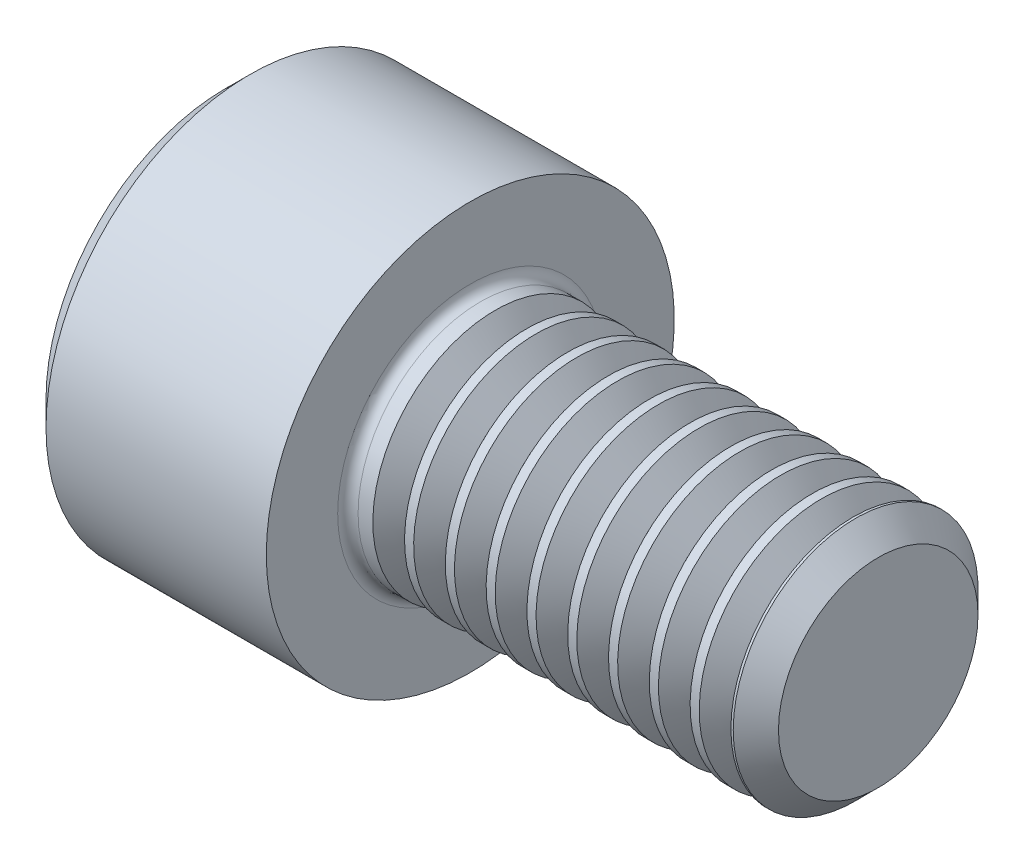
SolidWorks part; units mm, degrees
ref_plane "Plane1" through (0, 0, 0) normal (0, 0, 1) x (1, 0, 0)
ref_plane "Plane2" through (0, 0, 0) normal (0, 1, 0) x (1, 0, 0)
ref_plane "Plane3" through (0, 0, 0) normal (1, 0, 0) x (0, 0, -1)
sketch "BodySke" plane through (0, 0, 0) normal (0, 0, 1) x (1, 0, 0)
  line L0 (0, 0) -> (0, 4.4)
  line L1 (0.6, 5) -> (6, 5)
  line L2 (6, 5) -> (6, 3)
  line L3 (6, 3) -> (15.4455, 3)
  line L4 (16, 2.4455) -> (16, 0)
  line L5 (16, 0) -> (0, 0)
  line L6 (-31.75, 0) -> (127, 0) construction
  line L7 (0, 4.4) -> (0.6, 5)
  line L8 (16, 2.4455) -> (15.4455, 3)
  line L9 (0, -4.4) -> (0.6, -5) construction
  line L10 (16, -2.4455) -> (15.4455, -3) construction
  line L11 (7, 9.525) -> (7, 3.175) construction
  line L12 (6, 9.525) -> (6, 3.175) construction
  line L13 (-34, 9.525) -> (-34, 3.175) construction
  dimension "Diameter" = 6
  dimension "Head_ht" = 6
  dimension "Length" = 10
  dimension "Body_ch_ang" = 45
  dimension "Head_dia" = 10
  dimension "Head_ch_ang" = 45
  dimension "Minor_dia" = 4.891
  dimension "Advance" = 1
  dimension "Thread_nom" = 10
  dimension "Thread_length" = 50
  dimension "Head_ch_ht" = 0.6
revolve "Base-Revolve" add sketch "BodySke"
fillet "Fillet1" radius 0.25 1 edges at (6, 0, 3)
sketch "Sketch2" plane through (0, 0, 0) normal (0, 0, 1) x (1, 0, 0)
  line L0 (0, 2.542) -> (3, 2.542)
  line L1 (3, 2.542) -> (4.4676, 0)
  line L2 (-31.75, 0) -> (127, 0) construction
  line L3 (4.4676, 0) -> (0, 0)
  line L4 (0, 0) -> (0, 2.542)
  line L5 (0, 4.4) -> (0, -4.4) construction
  line L6 (0, 0) -> (47.625, 0) construction
  line L7 (6, -5) -> (6, 5) construction
  dimension "D1" = 2.542
  dimension "D2" = 60
  dimension "Wall_thickness" = 3
revolve "Hex-PreBroach" cut sketch "Sketch2" angle 360 about L6
sketch "Sketch3" plane through (0, 0, 0) normal (-1, 0, 0) x (0, 0.5, 0.866)
  line L0 (1.4676, 2.542) -> (-1.4676, 2.542)
  line L1 (-1.4676, 2.542) -> (-2.9352, 0)
  line L2 (1.4676, 2.542) -> (2.9352, 0)
  line L3 (1.4676, -2.542) -> (2.9352, 0)
  line L4 (1.4676, -2.542) -> (-1.4676, -2.542)
  line L5 (-1.4676, -2.542) -> (-2.9352, 0)
  dimension "D1" = 2.542
  dimension "D2" = 2.542
  dimension "Hex_size" = 5.084
extrude "Hex" cut sketch "Sketch3" against normal blind 3
sketch "Sketch4" plane through (0, 0, 0) normal (-1, 0, 0) x (0, 0, 1)
  line L0 (0, 0) -> (2.8067, 0)
  line L1 (0, 0) -> (6.1484, 3.5498) construction
  line L2 (0, 0) -> (1.4033, 2.4307)
  line L3 (2.3336, 0.614) -> (2.6851, 0.817)
  line L4 (1.6986, 1.7139) -> (2.0501, 1.9169)
  arc A0 (2.3336, 0.614) -> (1.6986, 1.7139) centre (0, 0) ccw
  arc A1 (2.8067, 0) -> (2.6851, 0.817) centre (0, 0) ccw
  arc A2 (1.4033, 2.4307) -> (2.0501, 1.9169) centre (0, 0) cw
  dimension "D1" = 30
  dimension "Spline_n_dim" = 4.826
  dimension "Spline_m_dim" = 5.6134
  dimension "D2" = 60
  dimension "D3" = 0.635
  dimension "Spline_p_dim" = 1.27
extrude "Spline" [suppressed] cut sketch "Sketch4" against normal blind 3
pattern_circular "CirPattern1" [suppressed] count 6 every 60
sketch "Sketch5" plane through (0, 0, 0) normal (0, 0, 1) x (1, 0, 0)
  line L0 (-31.75, 0) -> (127, 0) construction
  line L2 (0, 4.4) -> (0, -4.4) construction
  circle A0 centre (2.3, 0) radius 0.675
  dimension "Drilled_hole_dia" = 1.35
  dimension "Drilled_hole_loc" = 2.3
extrude "Hole" [suppressed] cut sketch "Sketch5" against normal through all and the other way through all
pattern_circular "Drilled-4" [suppressed] count 2 every 60
pattern_circular "Drilled-6" [suppressed] count 3 every 60
sketch "ThdSchSke" plane through (0, 0, 0) normal (0, 0, 1) x (1, 0, 0)
  line L0 (7, -2.4455) -> (6.6117, -3)
  line L1 (7, -2.4455) -> (7.3883, -3)
  line L2 (7.3883, -3) -> (7.3883, -3.75)
  line L3 (-3.175, 0) -> (5.1513, 0) construction
  line L5 (7.3883, -3.75) -> (6.6117, -3.75)
  line L6 (6.6117, -3.75) -> (6.6117, -3)
  line L7 (0, 4.4) -> (0, -4.4) construction
  dimension "Thread_minor" = 4.891
  dimension "Diameter" = 6
  dimension "Start" = 7
  dimension "SideAngle" = 55
  dimension "VeeAngle" = 70
  dimension "Overcut" = 7.5
revolve "ThreadSchematic" cut sketch "ThdSchSke" angle 360 about L3
pattern_linear "ThdSchPat" count 9 spacing 1 along (1, 0, 0) of "ThreadSchematic"
equation "\"D2@Sketch3\" = \"Hex_size@Sketch3\" / 2"
equation "\"D1@Sketch3\" = \"Hex_size@Sketch3\" / 2"
equation "\"D1@Sketch2\" = \"Hex_size@Sketch3\" / 2"
equation "\"D3@Sketch4\" = \"Spline_p_dim@Sketch4\" / 2"
equation "\"Thread_minor@ThreadCosmetic\"  =  \"Minor_dia@BodySke\""
equation "\"D2@CirPattern1\" = 360 / \"Num_teeth@CirPattern1\""
equation "\"Wall_thickness@Sketch2\" = \"Head_ht@BodySke\" - \"Key_eng@Hex\""
equation "\"Thread_length@ThreadCosmetic\" = ((sgn( (\"Length@BodySke\" - \"Advance@BodySke\" ) - \"Thread_nom@BodySke\" )-1)*( (\"Length@BodySke\" - \"Advance@BodySke\" ) - \"Thread_nom@BodySke\" ))/-2+ \"Thread_nom@BodySke\""
equation "\"Thread_minor@ThdSchSke\" = \"Minor_dia@BodySke\""
equation "\"Diameter@ThdSchSke\" = \"Diameter@BodySke\""
equation "\"Overcut@ThdSchSke\" = \"Diameter@BodySke\" * 1.25"
equation "\"Start@ThdSchSke\" = \"Head_ht@BodySke\" + \"Length@BodySke\" - \"Thread_length@ThreadCosmetic\"  '---Non-countersunk---"
equation "\"Num_threads@ThdSchPat\" = int( \"Thread_length@ThreadCosmetic\" / \"Advance@BodySke\" + 0.999 )  + 1"
equation "\"Advance@ThdSchPat\" = \"Thread_length@ThreadCosmetic\" /  (\"Num_threads@ThdSchPat\" - 1) 'relax it"
equation "\"Num_threads@ThdSchPat\" = \"Num_threads@ThdSchPat\" - sgn( \"Num_threads@ThdSchPat\" - 1) '---chamfered tips only---"
